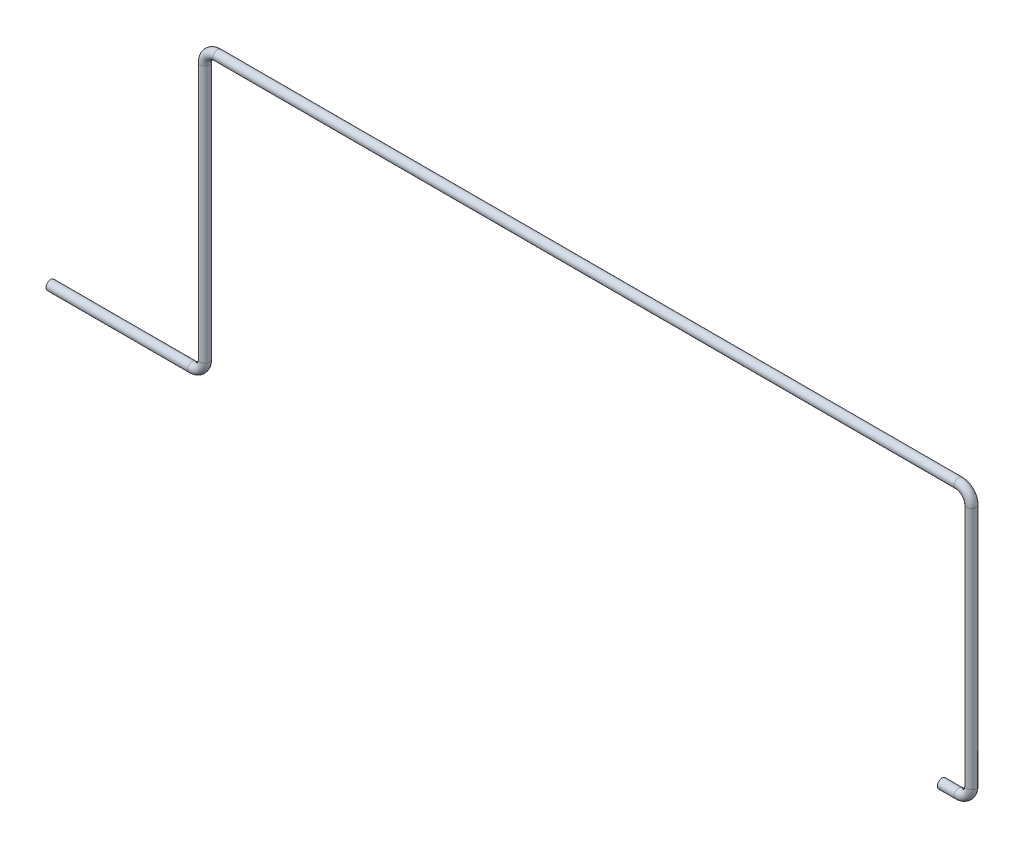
SolidWorks part; units mm, degrees
ref_plane "Alzado" through (0, 0, 0) normal (0, 0, 1) x (1, 0, 0)
ref_plane "Planta" through (0, 0, 0) normal (0, 1, 0) x (1, 0, 0)
ref_plane "Vista lateral" through (0, 0, 0) normal (1, 0, 0) x (0, 0, -1)
sketch "Croquis1" plane through (0, 0, 0) normal (0, 0, 1) x (1, 0, 0)
  line L1 (0, 0) -> (675, 0)
  line L2 (735, 60) -> (735, 1286.4)
  line L3 (795, 1346.4) -> (4325, 1346.4)
  line L4 (4385, 1286.4) -> (4385, 126.4)
  line L5 (4325, 66.4) -> (4245, 66.4)
  arc A0 (4385, 126.4) -> (4325, 66.4) centre (4325, 126.4) cw
  arc A1 (4325, 1346.4) -> (4385, 1286.4) centre (4325, 1286.4) cw
  arc A2 (735, 1286.4) -> (795, 1346.4) centre (795, 1286.4) cw
  arc A3 (675, 0) -> (735, 60) centre (675, 60) ccw
  point P10 (4385, 66.4)
  point P13 (4385, 1346.4)
  point P16 (735, 1346.4)
  point P20 (735, 0)
  dimension "D6" = 60
  dimension "D1" = 735
  dimension "D2" = 1346.4
  dimension "D3" = 3650
  dimension "D4" = 1280
  dimension "D5" = 140
sketch "Croquis3" plane through (0, 0, 0) normal (1, 0, 0) x (0, 0, -1)
  circle A0 centre (0, 0) radius 22.25
  circle A1 centre (0, 0) radius 19.05
  dimension "D1" = 44.5
  dimension "D2" = 38.1
sweep "Barrer1" add profiles "Croquis3" path "Croquis1"
